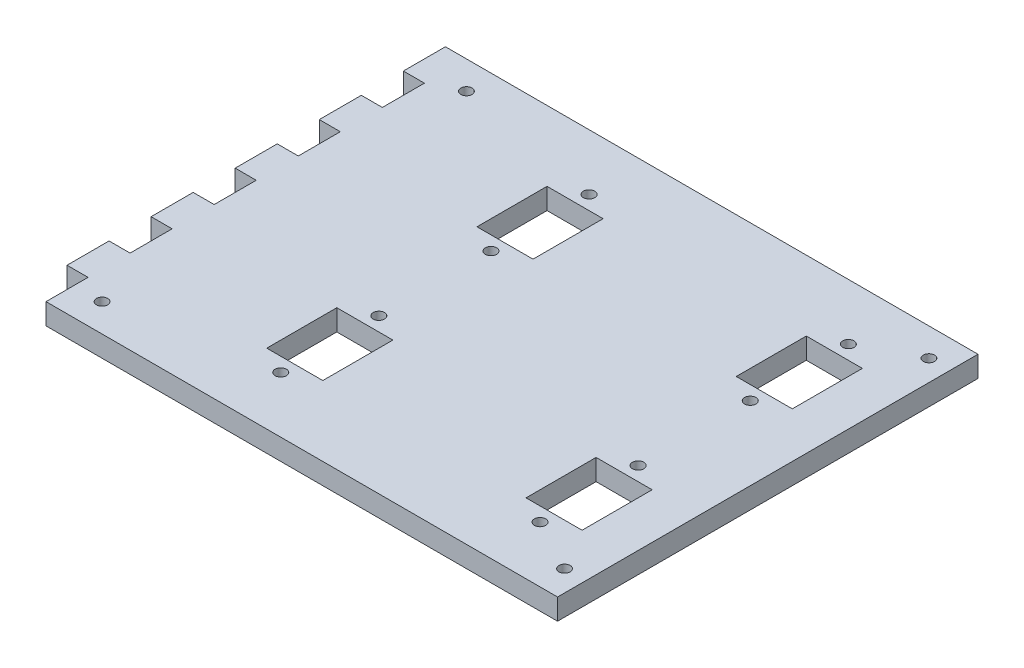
SolidWorks part; units mm, degrees
ref_plane "Plan de face" through (0, 0, 0) normal (0, 0, 1) x (1, 0, 0)
ref_plane "Plan de dessus" through (0, 0, 0) normal (0, 1, 0) x (1, 0, 0)
ref_plane "Plan de droite" through (0, 0, 0) normal (1, 0, 0) x (0, 0, -1)
sketch "Esquisse2" plane through (0, 0, 0) normal (0, 1, 0) x (1, 0, 0)
  line L1 (0, 0) -> (380, 0)
  line L2 (0, 0) -> (0, -300)
  line L3 (0, -300) -> (380, -300)
  line L4 (380, 0) -> (380, -300)
  dimension "D1" = 380
  dimension "D2" = 300
extrude "Boss.-Extru.1" add sketch "Esquisse2" along normal blind 15
sketch "Esquisse3" plane through (0, 15, 0) normal (0, 1, 0) x (1, 0, 0)
  line L1 (0, 0) -> (0, -300) construction
  line L2 (0, -30) -> (15, -30)
  line L3 (15, -30) -> (15, -60)
  line L4 (15, -60) -> (0, -60)
  line L5 (0, -60) -> (0, -30)
  dimension "D1" = 30
  dimension "D2" = 30
  dimension "D3" = 15
extrude "Enlèv. mat.-Extru.1" cut sketch "Esquisse3" against normal through all
pattern_linear "Répétition linéaire2" count 10 spacing 60 along (0, 0, 1) of "Enlèv. mat.-Extru.1"
sketch "Esquisse4" plane through (0, 0, 0) normal (0, -1, 0) x (1, 0, 0)
  line L0 (380, 0) -> (0, 0) construction
  line L9 (15, 300) -> (380, 300) construction
  line L10 (327.5, 25) -> (327.5, 75) construction
  line L12 (142.5, 31.3773) -> (142.5, 368.6227) construction
  line L14 (0, 0) -> (0, 30) construction
  line L15 (347.5, 50) -> (307.5, 50)
  line L16 (347.5, 50) -> (347.5, 100)
  line L17 (347.5, 100) -> (307.5, 100)
  line L18 (307.5, 50) -> (307.5, 100)
  line L19 (347.5, 200) -> (307.5, 200)
  line L20 (347.5, 200) -> (347.5, 250)
  line L21 (347.5, 250) -> (307.5, 250)
  line L22 (307.5, 200) -> (307.5, 250)
  line L23 (162.5, 50) -> (122.5, 50)
  line L24 (162.5, 50) -> (162.5, 100)
  line L25 (162.5, 100) -> (122.5, 100)
  line L26 (122.5, 50) -> (122.5, 100)
  line L27 (162.5, 200) -> (122.5, 200)
  line L28 (162.5, 200) -> (162.5, 250)
  line L29 (162.5, 250) -> (122.5, 250)
  line L30 (122.5, 200) -> (122.5, 250)
  point P11 (327.5, 200)
  point P22 (327.5, 50)
  point P29 (142.5, 200)
  point P30 (142.5, 50)
  dimension "D1" = 185
  dimension "D2" = 40
  dimension "D3" = 50
  dimension "D4" = 327.5
  dimension "D6" = 50
  dimension "D7" = 50
extrude "Enlèv. mat.-Extru.2" cut sketch "Esquisse4" against normal through all
sketch "Esquisse5" plane through (0, 0, 0) normal (0, -1, 0) x (1, 0, 0)
  line L0 (330, 10) -> (330, 140) construction
  line L1 (347.5, 50) -> (347.5, 100) construction
  line L2 (307.5, 100) -> (307.5, 50) construction
  line L3 (330, 160) -> (330, 290) construction
  line L4 (307.5, 250) -> (307.5, 200) construction
  circle A0 centre (330, 10) radius 4
  circle A1 centre (330, 140) radius 4
  circle A2 centre (330, 160) radius 4
  circle A3 centre (330, 290) radius 4
  circle A4 centre (130.281, 288.1358) radius 4
  circle A5 centre (130.281, 207.9366) radius 4
  circle A6 centre (134.1556, 103.9213) radius 4
  circle A7 centre (134.1556, 18.3273) radius 4
  point P18 (347.5, 75)
  point P19 (330, 75)
  point P24 (307.5, 225)
  point P25 (330, 225)
  dimension "D1" = 8
  dimension "D2" = 130
  dimension "D3" = 22.5
  dimension "D4" = 130
sketch "Esquisse6" plane through (0, 15, 0) normal (0, 1, 0) x (1, 0, 0)
  line L0 (380, -300) -> (380, 0) construction
  line L1 (380, 0) -> (0, 0) construction
  line L2 (15, -300) -> (380, -300) construction
  line L3 (15, -300) -> (15, -270) construction
  circle A0 centre (365, -280) radius 4
  circle A1 centre (365, -20) radius 4
  circle A2 centre (35, -280) radius 4
  circle A3 centre (35, -20) radius 4
  dimension "D1" = 8
  dimension "D3" = 20
  dimension "D5" = 20
  dimension "D2" = 15
  dimension "D4" = 20
extrude "Enlèv. mat.-Extru.3" cut sketch "Esquisse6" against normal through all
sketch "Esquisse7" plane through (0, 15, 0) normal (0, 1, 0) x (1, 0, 0)
  circle A0 centre (327.5, -40) radius 4.05
  circle A1 centre (327.5, -110) radius 4.05
  circle A2 centre (327.5, -190) radius 4.05
  circle A3 centre (327.5, -260) radius 4.05
  circle A4 centre (142.5, -260) radius 4.05
  circle A5 centre (142.5, -190) radius 4.05
  circle A6 centre (142.5, -40) radius 4.05
  circle A8 centre (142.5, -110) radius 4.05
  dimension "D1" = 8.1
extrude "Enlèv. mat.-Extru.4" cut sketch "Esquisse7" against normal through all
